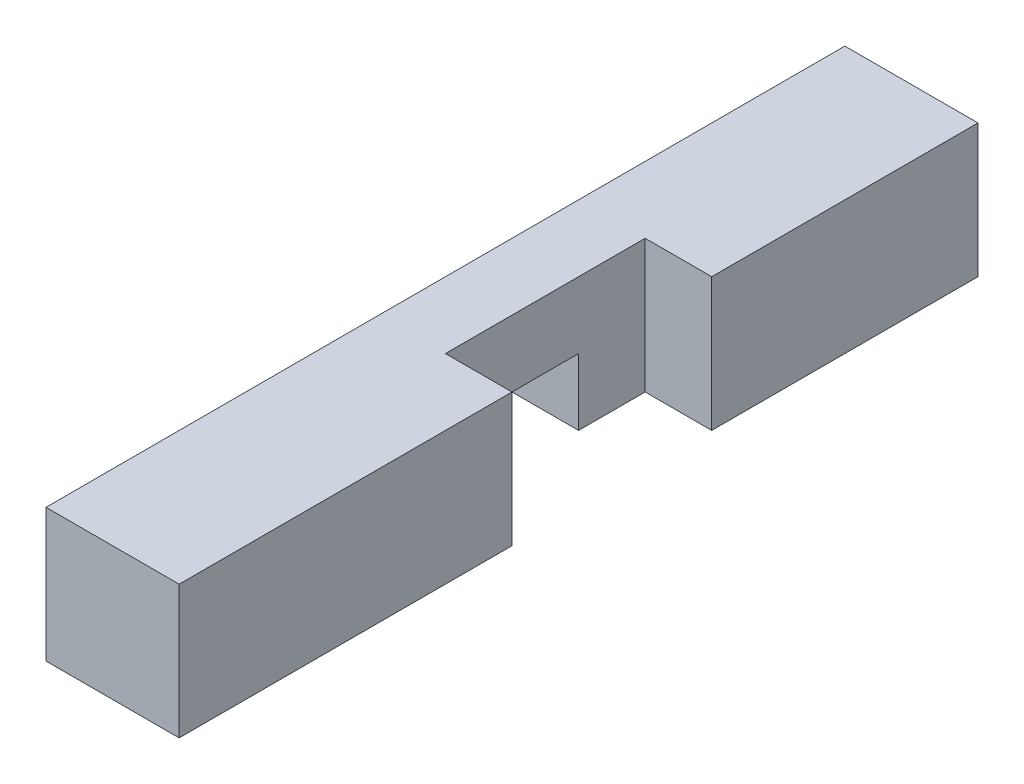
SolidWorks part; units mm, degrees
ref_plane "Front Plane" through (0, 0, 0) normal (0, 0, 1) x (1, 0, 0)
ref_plane "Top Plane" through (0, 0, 0) normal (0, 1, 0) x (1, 0, 0)
ref_plane "Right Plane" through (0, 0, 0) normal (1, 0, 0) x (0, 0, -1)
sketch "Sketch1" plane through (0, 0, 0) normal (0, 0, 1) x (1, 0, 0)
  line L1 (0, 0) -> (20, 0)
  line L2 (0, 0) -> (0, 20)
  line L3 (0, 20) -> (20, 20)
  line L4 (20, 0) -> (20, 20)
  dimension "D1" = 20
extrude "Extrude1" add sketch "Sketch1" along normal blind 120
sketch "Sketch2" plane through (0, 20, 0) normal (0, 1, 0) x (1, 0, 0)
  line L0 (20, -120) -> (20, 0) construction
  line L1 (20, -70) -> (10, -70)
  line L2 (20, -70) -> (20, -40)
  line L3 (20, -40) -> (10, -40)
  line L4 (10, -70) -> (10, -40)
  line L5 (20, -120) -> (0, -120) construction
  dimension "D1" = 10
  dimension "D2" = 50
  dimension "D3" = 30
extrude "Extrude2" cut sketch "Sketch2" against normal through all
sketch "Sketch3" plane through (10, 0, 0) normal (1, 0, 0) x (0, 0, -1)
  line L0 (-40, 0) -> (-70, 0) construction
  line L1 (-70, 0) -> (-50, 0)
  line L2 (-70, 0) -> (-70, 10)
  line L3 (-70, 10) -> (-50, 10)
  line L4 (-50, 0) -> (-50, 10)
  line L5 (-120, 0) -> (-120, 20) construction
  dimension "D1" = 10
  dimension "D2" = 20
  dimension "D3" = 50
extrude "Extrude3" cut sketch "Sketch3" against normal through all
